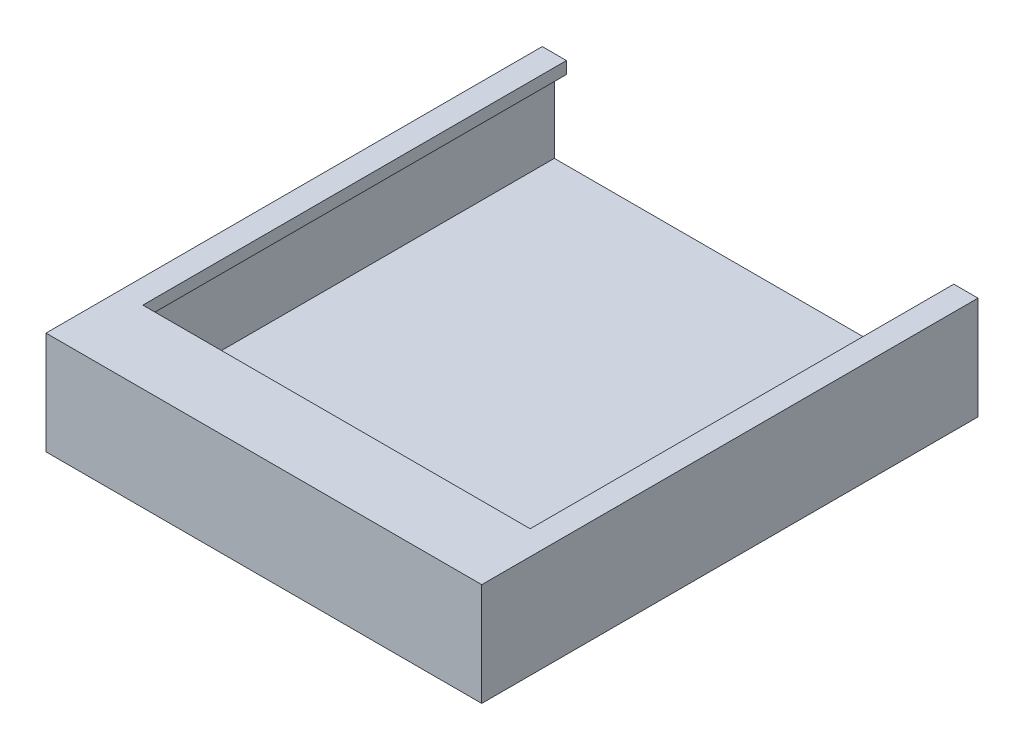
SolidWorks part; units mm, degrees
ref_plane "Front Plane" through (0, 0, 0) normal (0, 0, 1) x (1, 0, 0)
ref_plane "Top Plane" through (0, 0, 0) normal (0, 1, 0) x (1, 0, 0)
ref_plane "Right Plane" through (0, 0, 0) normal (1, 0, 0) x (0, 0, -1)
sketch "Sketch1" plane through (0, 0, 0) normal (0, 1, 0) x (1, 0, 0)
  line L1 (-34, 40) -> (34, 40)
  line L2 (-34, 40) -> (-34, -40)
  line L3 (-34, -40) -> (34, -40)
  line L4 (34, 40) -> (34, -40)
  line L5 (-34, 40) -> (34, -40) construction
  line L6 (-34, -40) -> (34, 40) construction
  point P0 (0, 0)
  dimension "D1" = 80
  dimension "D2" = 68
extrude "Boss-Extrude1" add sketch "Sketch1" along normal blind 2
sketch "Sketch2" plane through (0, 0, 0) normal (0, 1, 0) x (1, 0, 0)
  line L0 (-34, 40) -> (-34, -40) construction
  line L1 (34, 40) -> (36, 40)
  line L2 (34, 40) -> (34, -40)
  line L3 (34, -40) -> (36, -40)
  line L4 (36, 40) -> (36, -40)
  line L6 (-34, 40) -> (-36, 40)
  line L7 (-34, 40) -> (-34, -40)
  line L8 (-34, -40) -> (-36, -40)
  line L9 (-36, 40) -> (-36, -40)
  dimension "D1" = 2
  dimension "D2" = 2
extrude "Boss-Extrude2" add sketch "Sketch2" along normal blind 17
sketch "Sketch3" plane through (0, 0, 0) normal (0, 1, 0) x (1, 0, 0)
  line L0 (36, -40) -> (36, 40) construction
  line L1 (-36, -40) -> (36, -40)
  line L2 (-36, -40) -> (-36, -42)
  line L3 (-36, -42) -> (36, -42)
  line L4 (36, -40) -> (36, -42)
  line L5 (-36, 40) -> (-36, -40) construction
  dimension "D1" = 2
extrude "Boss-Extrude3" add sketch "Sketch3" along normal blind 17
sketch "Sketch4" plane through (0, 0, 40) normal (0, 0, -1) x (-1, 0, 0)
  line L0 (34, 17) -> (34, 2) construction
  line L1 (-34, 17) -> (34, 17)
  line L2 (-34, 17) -> (-34, 15)
  line L3 (-34, 15) -> (34, 15)
  line L4 (34, 17) -> (34, 15)
  dimension "D1" = 2
extrude "Boss-Extrude4" add sketch "Sketch4" along normal blind 10
sketch "Sketch8" plane through (34, 0, 0) normal (-1, 0, 0) x (0, 0, 1)
  line L1 (30, 15) -> (-40, 15)
  line L2 (30, 15) -> (30, 17)
  line L3 (30, 17) -> (-40, 17)
  line L4 (-40, 15) -> (-40, 17)
extrude "Boss-Extrude5" add sketch "Sketch8" along normal blind 2
sketch "Sketch10" plane through (-34, 0, 0) normal (1, 0, 0) x (0, 0, -1)
  line L1 (-30, 15) -> (40, 15)
  line L2 (-30, 15) -> (-30, 17)
  line L3 (-30, 17) -> (40, 17)
  line L4 (40, 15) -> (40, 17)
extrude "Boss-Extrude6" add sketch "Sketch10" along normal blind 2
